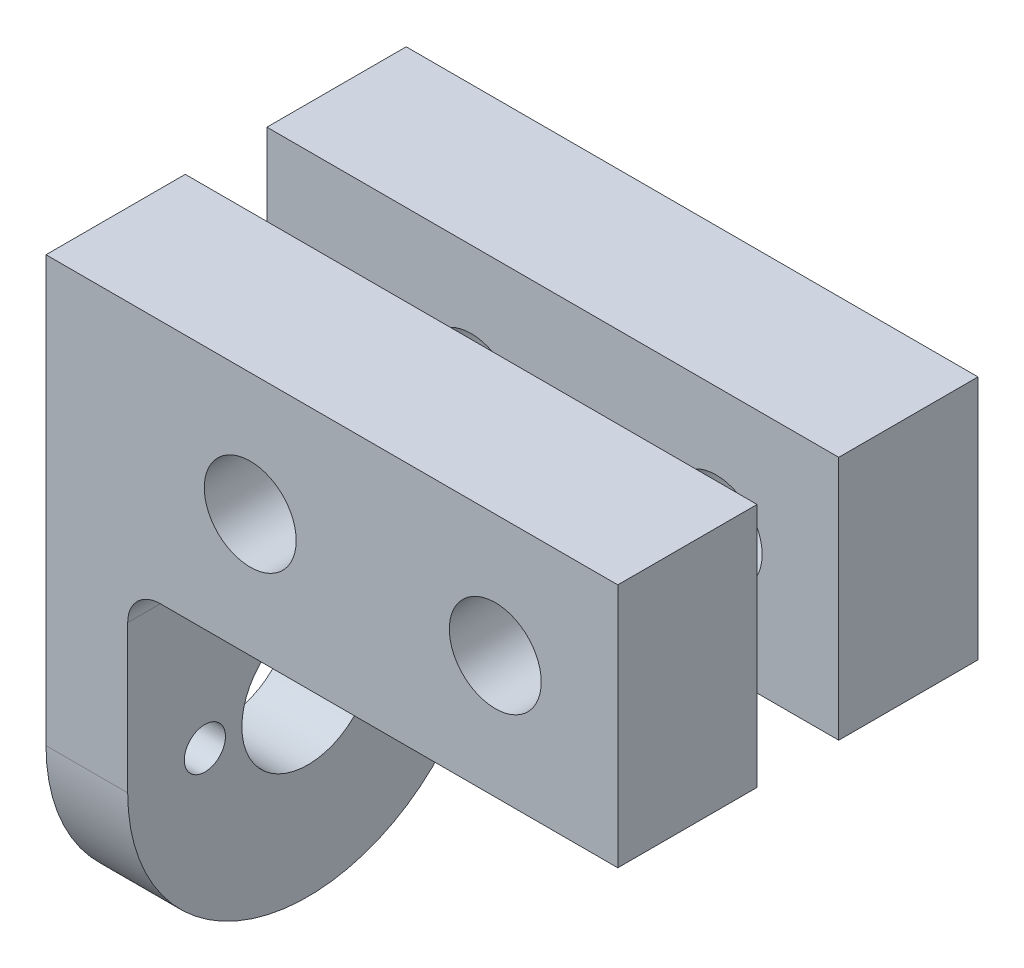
SolidWorks part; units mm, degrees
ref_plane "Front Plane" through (0, 0, 0) normal (0, 0, 1) x (1, 0, 0)
ref_plane "Top Plane" through (0, 0, 0) normal (0, 1, 0) x (1, 0, 0)
ref_plane "Right Plane" through (0, 0, 0) normal (1, 0, 0) x (0, 0, -1)
sketch "Sketch1" plane through (0, 0, 0) normal (1, 0, 0) x (0, 0, -1)
  line L1 (-14, -9.525) -> (14, -9.525)
  line L2 (-14, -9.525) -> (-14, 9.525)
  line L3 (-14, 9.525) -> (14, 9.525)
  line L4 (14, -9.525) -> (14, 9.525)
  line L5 (-14, -9.525) -> (14, 9.525) construction
  line L6 (-14, 9.525) -> (14, -9.525) construction
  line L7 (-3.175, -9.525) -> (3.175, -9.525)
  line L8 (-3.175, -9.525) -> (-3.175, 9.525)
  line L9 (-3.175, 9.525) -> (3.175, 9.525)
  line L10 (3.175, -9.525) -> (3.175, 9.525)
  line L11 (-3.175, -9.525) -> (3.175, 9.525) construction
  line L12 (-3.175, 9.525) -> (3.175, -9.525) construction
  point P0 (0, 0)
  point P6 (0, 0)
  dimension "D1" = 6.35
  dimension "D2" = 28
  dimension "D3" = 19.05
extrude "Boss-Extrude1" add sketch "Sketch1" against normal blind 38.1 contours L1 L8 L3 L2 | L10 L1 L4 L3
sketch "Sketch2" plane through (0, 0, 14) normal (0, 0, 1) x (1, 0, 0)
  line L0 (-38.1, 9.525) -> (-38.1, -9.525) construction
  line L1 (-38.1, 9.525) -> (0, 9.525) construction
  line L2 (-38.1, -9.525) -> (0, -9.525) construction
  line L3 (0, -9.525) -> (0, 9.525) construction
  circle A0 centre (-28.575, 0) radius 3.5719
  circle A1 centre (-9.525, 0) radius 3.5719
  dimension "D2" = 9.525
  dimension "D3" = 9.525
  dimension "D4" = 7.1437
  dimension "D5" = 7.1437
  dimension "D1" = 38.1
extrude "Cut-Extrude1" cut sketch "Sketch2" against normal through all and the other way through all
sketch "Sketch3" plane through (-38.1, 0, 0) normal (-1, 0, 0) x (0, 0, 1)
  line L0 (-14, -9.525) -> (-14, -23.525)
  line L5 (14, -9.525) -> (14, -23.525)
  line L6 (3.175, -9.525) -> (14, -9.525) construction
  line L7 (14, -9.525) -> (14, 9.525) construction
  line L8 (14, 9.525) -> (3.175, 9.525) construction
  line L9 (3.175, 9.525) -> (3.175, -9.525) construction
  line L10 (-3.175, -9.525) -> (-3.175, 9.525) construction
  line L11 (-3.175, 9.525) -> (-14, 9.525) construction
  line L12 (-14, 9.525) -> (-14, -9.525) construction
  line L13 (-14, -9.525) -> (-3.175, -9.525) construction
  line L14 (3.175, -9.525) -> (14, -9.525)
  line L15 (14, -9.525) -> (14, 9.525)
  line L16 (14, 9.525) -> (3.175, 9.525)
  line L17 (3.175, 9.525) -> (3.175, -9.525)
  line L18 (-3.175, -9.525) -> (-3.175, 9.525)
  line L19 (-3.175, 9.525) -> (-14, 9.525)
  line L20 (-14, 9.525) -> (-14, -9.525)
  line L21 (-14, -9.525) -> (-3.175, -9.525)
  line L22 (-3.175, 9.525) -> (3.175, 9.525)
  line L23 (-3.175, -9.525) -> (3.175, -9.525)
  circle A0 centre (0, -23.525) radius 14
  circle A1 centre (0, -23.525) radius 8 construction
  circle A2 centre (8, -23.525) radius 1.6
  circle A3 centre (-8, -23.525) radius 1.6
  circle A4 centre (0, -23.525) radius 5.125
  point P17 (0, 0)
  point P19 (0, 0)
  point P21 (-13.4694, -9.525)
  dimension "D1" = 28
  dimension "D2" = 16
  dimension "D3" = 3.2
  dimension "D4" = 3.2
  dimension "D5" = 10.25
extrude "Boss-Extrude2" add sketch "Sketch3" along normal blind 6.35
fillet "Fillet1" radius 2.54 2 edges at (-38.1, -9.525, -8.5875) (-38.1, -9.525, 8.5875)
